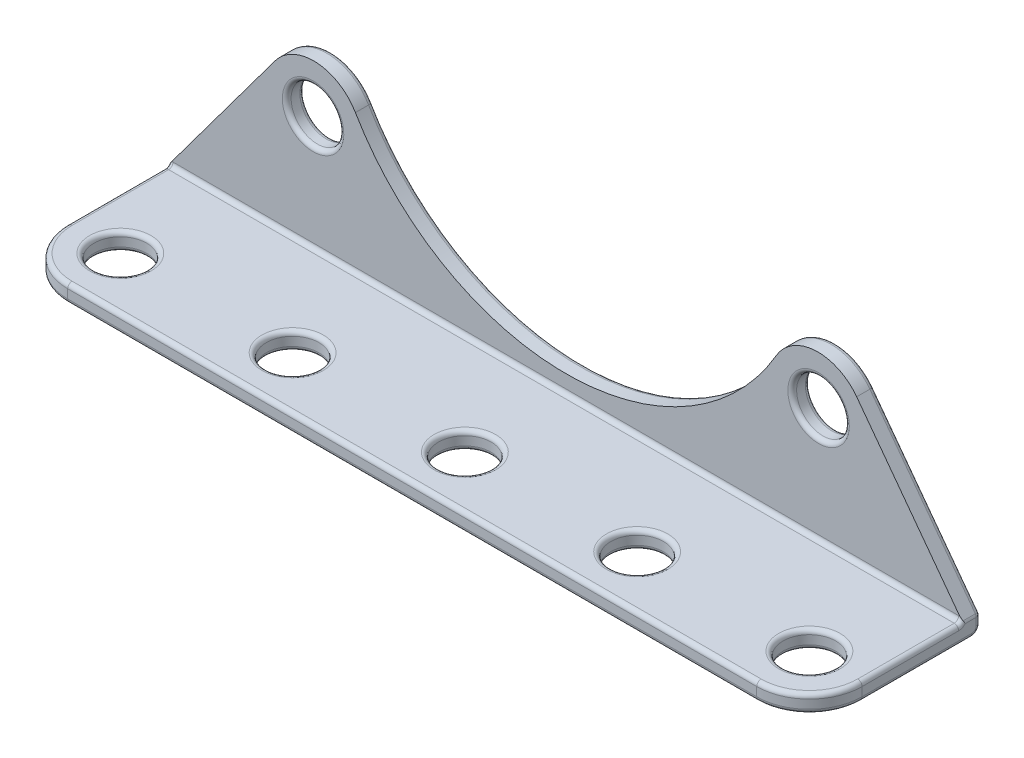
SolidWorks part; units mm, degrees
ref_plane "Front Plane" through (0, 0, 0) normal (0, 0, 1) x (1, 0, 0)
ref_plane "Top Plane" through (0, 0, 0) normal (0, 1, 0) x (1, 0, 0)
ref_plane "Right Plane" through (0, 0, 0) normal (1, 0, 0) x (0, 0, -1)
sketch "Sketch1" plane through (0, 0, 0) normal (1, 0, 0) x (0, 0, -1)
  line L1 (0, 0) -> (9.906, 0)
  line L2 (0, 0) -> (0, 1.016)
  line L3 (8.89, 10.922) -> (9.906, 10.922)
  line L4 (9.906, 0) -> (9.906, 10.922)
  line L7 (0, 1.016) -> (8.89, 1.016)
  line L8 (8.89, 10.922) -> (8.89, 1.016)
  dimension "D1" = 1.016
  dimension "D2" = 1.016
  dimension "D3" = 10.922
  dimension "D4" = 9.906
extrude "Bracket" add sketch "Sketch1" along normal blind 45.974
sketch "Sketch2" plane through (0, 0, -8.89) normal (0, 0, 1) x (1, 0, 0)
  line L0 (22.987, 10.922) -> (22.987, 13.6108) construction
  line L1 (45.974, 10.922) -> (0, 10.922) construction
  line L2 (22.987, 13.6108) -> (22.987, -1.1981) construction
  line L3 (22.987, 2.032) -> (48.9907, 2.032) construction
  line L4 (45.974, 12.5044) -> (0, 12.5044)
  line L5 (0, 12.5044) -> (0, 1.016)
  line L6 (45.974, 0) -> (0, 0) construction
  line L7 (0, 1.016) -> (6.1542, 9.2878)
  line L8 (45.974, 1.016) -> (39.8198, 9.2878)
  line L9 (45.974, 12.5044) -> (45.974, 1.016)
  arc A0 (39.8198, 9.2878) -> (35.1646, 9.0275) centre (37.5782, 7.62) ccw
  arc A1 (35.1646, 9.0275) -> (10.8094, 9.0275) centre (22.987, 16.129) cw
  arc A2 (6.1542, 9.2878) -> (10.8094, 9.0275) centre (8.3958, 7.62) cw
  point P16 (22.987, 2.032)
  point P22 (22.987, 12.5044)
  point P23 (22.987, 12.5044)
  point P24 (22.987, 12.5044)
  point P26 (22.987, 12.5044)
  dimension "D2" = 5.588
  dimension "D1" = 7.62
  dimension "D3" = 14.097
  dimension "D5" = 2.032
extrude "Curvature cut" cut sketch "Sketch2" against normal through all
ref_plane "Plane1" through (22.987, 0, 0) normal (1, 0, 0) x (0, 0, -1)
sketch "Sketch3" plane through (0, 0, -8.89) normal (0, 0, 1) x (1, 0, 0)
  line L4 (22.987, 0) -> (22.987, 11.9642) construction
  line L5 (45.974, 0) -> (0, 0) construction
  circle A0 centre (8.3591, 7.62) radius 1.524
  dimension "D1" = 14.6279
  dimension "D2" = 3.048
  dimension "D3" = 7.62
extrude "Upper hole" cut sketch "Sketch3" against normal through all
mirror "Mirror for upper hole" about plane through (22.987, 0, 0) normal (1, 0, 0) of "Upper hole"
sketch "Sketch4" plane through (0, 1.016, 0) normal (0, 1, 0) x (1, 0, 0)
  line L0 (0, 8.89) -> (0, 0) construction
  line L1 (0, 9.906) -> (6.1542, 9.906) construction
  circle A0 centre (3.048, 3.048) radius 1.524
  dimension "D1" = 3.048
  dimension "D2" = 6.858
  dimension "D3" = 3.048
extrude "Lower hole" cut sketch "Sketch4" against normal through all
pattern_linear "Linear pattern for lower hole" count 5 spacing 9.9695 along (1, 0, 0) of "Lower hole"
fillet "Lower corner fillet" radius 3.048 2 edges at (45.974, 0.508, 0) (0, 0.508, 0)
fillet "Lower surface fillet" radius 0.254 13 edges at (42.926, 1.016, -1.524) (32.9565, 1.016, -1.524) (22.987, 1.016, -1.524) (0.8927, 1.016, -0.8927) (0, 1.016, -5.969) (22.987, 1.016, -8.89) (45.974, 1.016, -5.969) (45.0813, 1.016, -0.8927) (22.987, 1.016, 0) (3.048, 1.016, -1.524) (13.0175, 1.016, -1.524) (45.974, 1.016, -9.398) (0, 1.016, -9.398)
fillet "Bracket flange fillet" radius 0.508 1 edges at (22.987, 0, -9.906)
fillet "Perimeter fillet" radius 0.254 25 edges at (45.974, 0.1488, -9.7572) (0, 0.1488, -9.7572) (42.926, 0, -1.524) (32.9565, 0, -1.524) (22.987, 0, -1.524) (0.8927, 0, -0.8927) (22.987, 0, 0) (45.0813, 0, -0.8927) (45.974, 0, -6.223) (0, 0, -6.223) (3.048, 0, -1.524) (13.0175, 0, -1.524) (37.4222, 10.4096, -9.906) (42.8718, 5.1856, -9.906) (45.9611, 1.0117, -9.906) (45.974, 0.7199, -9.906) (0, 0.7199, -9.906) (36.0909, 7.62, -8.89) (36.0909, 7.62, -9.906) (9.8831, 7.62, -8.89) (9.8831, 7.62, -9.906) (22.987, 2.032, -9.906) (8.5518, 10.4096, -9.906) (3.1022, 5.1856, -9.906) (0.0129, 1.0117, -9.906)
